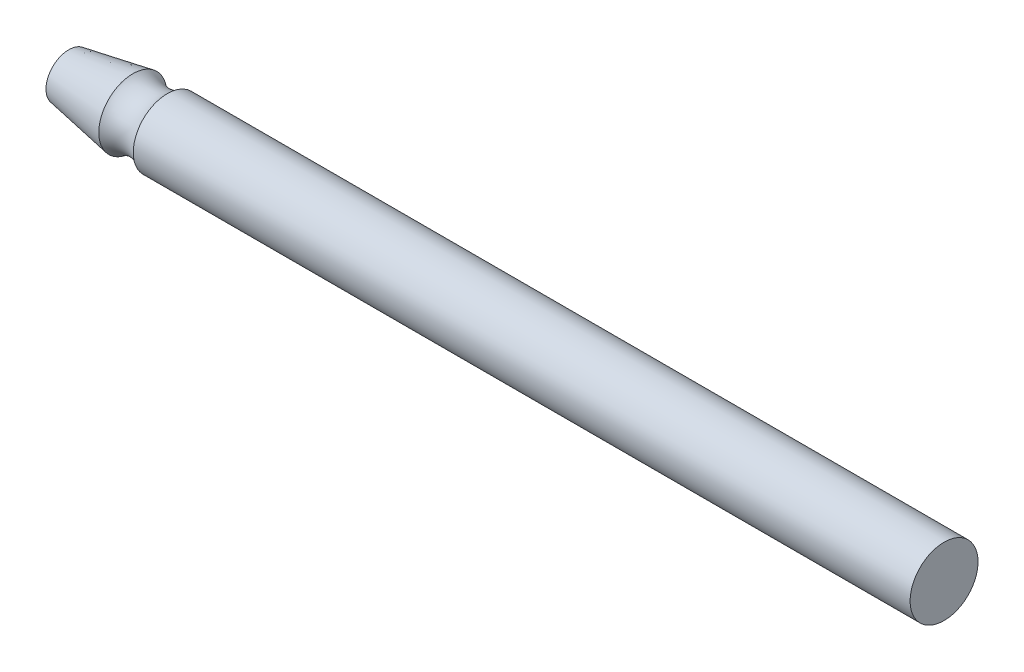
SolidWorks part; units mm, degrees
ref_plane "Plan de face" through (0, 0, 0) normal (0, 0, 1) x (1, 0, 0)
ref_plane "Plan de dessus" through (0, 0, 0) normal (0, 1, 0) x (1, 0, 0)
ref_plane "Plan de droite" through (0, 0, 0) normal (1, 0, 0) x (0, 0, -1)
sketch "Esquisse1" plane through (0, 0, 0) normal (0, 0, 1) x (1, 0, 0)
  line L0 (-45.075, 0) -> (45.075, 0)
  line L1 (-34.925, 3.5) -> (45.075, 3.5)
  line L2 (45.075, 3.5) -> (45.075, 0)
  line L3 (-45.075, 0) -> (-45.075, 2.3362)
  line L4 (-45.075, 2.3362) -> (-38.475, 3.5)
  arc A0 (-34.925, 3.5) -> (-38.475, 3.5) centre (-36.7, 5.6655) cw
  dimension "D1" = 80
  dimension "D3" = 2.8
  dimension "D2" = 3.5
  dimension "D4" = 10
  dimension "D5" = 3.55
  dimension "D6" = 6.6
revolve "Révolution1" add sketch "Esquisse1" angle 360 about L0
hole_wizard "Trou taraudé M31" positions "Esquisse2" profile "Esquisse4" tap size "M3" standard "ISO"
sketch "Esquisse2" plane through (-45.075, 0, 0) normal (-1, 0, 0) x (0, 0, 1)
  point P0 (0, 0)
sketch "Esquisse4" plane through (-45.075, 0, 0) normal (0, 1, 0) x (0, 0, 1)
  line L0 (0, 0) -> (0, 18.7511)
  line L1 (0, 18.7511) -> (1.25, 18)
  line L2 (1.25, 18) -> (1.25, 0.3164)
  line L3 (1.25, 0.3164) -> (1.525, 0)
  line L5 (1.525, 0) -> (0, 0)
  line L6 (-1.25, 0.3164) -> (-1.525, 0) construction
  line L10 (0, 18.7511) -> (-1.25, 18) construction
  line L11 (0, -6.35) -> (0, 107.95) construction
  dimension "Diamètre du trou pour taraudage" = 2.5
  dimension "Profondeur du trou pour taraudage" = 18
  dimension "Diamètre du fraisage entrant" = 3.05
  dimension "Angle du fraisage entrant" = 82
  dimension "Angle de pointe" = 118
thread "Filetage1" pitch 1 start angle 0, offset 2, length 39, pitch 1, diameter 7
ref_plane "Plan1" through (-36.925, 0, -3.5) normal (0, -1, 0) x (0, 0, -1)
sketch "Profil de filetage1" plane through (-36.925, 0, -3.5) normal (0, -1, 0) x (0, 0, -1)
  line L0 (0, 0) -> (0, 1) construction
  line L11 (0, 0) -> (0, 0.875)
  line L12 (0, 0.875) -> (-0.5413, 0.5625)
  line L13 (-0.5413, 0.5625) -> (-0.5413, 0.3125)
  line L15 (-0.5413, 0.3125) -> (0, 0)
  line L17 (-0.5413, 0.4375) -> (0, 0.4375) construction
  point P2 (0, 0)
  dimension "Pitch" = 1
  dimension "Profile_Angle" = 60
  dimension "Profile_Land" = 0.25
  dimension "Profile_Height" = 0.5413
